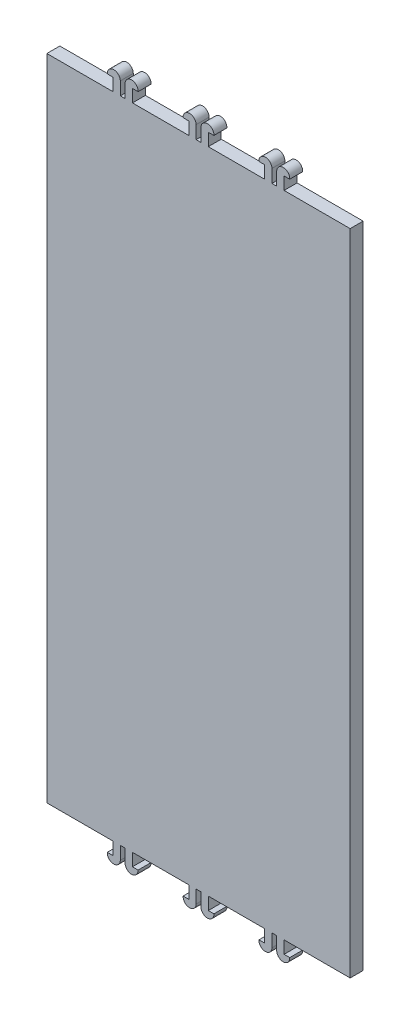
SolidWorks part; units mm, degrees
ref_plane "Front Plane" through (0, 0, 0) normal (0, 0, 1) x (1, 0, 0)
ref_plane "Top Plane" through (0, 0, 0) normal (0, 1, 0) x (1, 0, 0)
ref_plane "Right Plane" through (0, 0, 0) normal (1, 0, 0) x (0, 0, -1)
sketch "Sketch1" plane through (0, 0, 0) normal (0, 0, 1) x (1, 0, 0)
  line L0 (0.654, 37.5) -> (0.654, 40.5) construction
  line L1 (35.05, -37.5) -> (-35.05, -37.5) construction
  line L2 (35.05, -112.5) -> (35.05, 37.5)
  line L3 (35.05, 37.5) -> (19.774, 37.5)
  line L4 (-35.05, -112.5) -> (-35.05, 37.5)
  line L5 (35.05, -37.5) -> (-35.05, 37.5) construction
  line L6 (35.05, 37.5) -> (-35.05, -37.5) construction
  line L7 (2.154, 37.5) -> (2.154, 40.5) construction
  line L8 (2.154, 40.5) -> (3.462, 40.5) construction
  line L9 (0, 0) -> (0, 29.6576) construction
  line L10 (3.462, 40.5) -> (3.462, 37.5) construction
  line L11 (0.554, 37.5) -> (0.554, 40.5)
  line L12 (2.254, 40.4) -> (3.5587, 40.4)
  line L13 (2.254, 37.5) -> (2.254, 40.4)
  line L14 (0.554, 37.5) -> (0.554, 40.5) construction
  line L15 (-2.254, 37.5) -> (-2.254, 40.4)
  line L16 (-2.254, 40.4) -> (-3.5587, 40.4)
  line L17 (-0.554, 37.5) -> (-0.554, 40.5)
  line L18 (0.654, 37.5) -> (-0.554, 37.5)
  line L19 (-2.254, 37.5) -> (-15.271, 37.5)
  line L20 (19.774, -112.5) -> (19.774, -115.4)
  line L21 (0.554, 37.5) -> (-0.554, 37.5)
  line L22 (0.654, 37.5) -> (0.554, 37.5) construction
  line L23 (2.254, 37.5) -> (2.154, 37.5) construction
  line L24 (-2.254, -112.5) -> (-15.271, -112.5)
  line L25 (-2.254, -112.5) -> (-2.254, -115.4)
  line L26 (-2.254, -115.4) -> (-3.5587, -115.4)
  line L27 (-0.554, -112.5) -> (-0.554, -115.5)
  line L28 (0.554, -112.5) -> (-0.554, -112.5)
  line L29 (0.554, -112.5) -> (0.554, -115.5)
  line L30 (2.254, -115.4) -> (3.5587, -115.4)
  line L31 (2.254, -112.5) -> (2.254, -115.4)
  line L32 (35.05, -112.5) -> (19.774, -112.5)
  line L33 (19.774, -115.4) -> (21.0787, -115.4)
  line L34 (15.266, 37.5) -> (2.254, 37.5)
  line L35 (-8.7625, 37.5) -> (-8.7625, 30.1564) construction
  line L36 (-19.779, 37.5) -> (-19.779, 40.4)
  line L37 (-19.779, 40.4) -> (-21.0837, 40.4)
  line L38 (-18.079, 37.5) -> (-18.079, 40.5)
  line L39 (-18.079, 37.5) -> (-16.971, 37.5)
  line L40 (-16.971, 37.5) -> (-16.971, 40.5)
  line L41 (-15.271, 40.4) -> (-13.9663, 40.4)
  line L42 (-15.271, 37.5) -> (-15.271, 40.4)
  line L43 (8.76, 37.5) -> (8.76, 30.1564) construction
  line L44 (-19.779, 37.5) -> (-35.05, 37.5)
  line L45 (-16.971, 37.5) -> (-18.079, 37.5)
  line L46 (15.266, 37.5) -> (15.266, 40.4)
  line L47 (15.266, 40.4) -> (13.9613, 40.4)
  line L48 (16.966, 37.5) -> (16.966, 40.5)
  line L49 (16.966, 37.5) -> (18.074, 37.5)
  line L50 (18.074, 37.5) -> (18.074, 40.5)
  line L51 (19.774, 40.4) -> (21.0787, 40.4)
  line L52 (19.774, 37.5) -> (19.774, 40.4)
  line L53 (18.074, 37.5) -> (16.966, 37.5)
  line L54 (2.254, 37.5) -> (2.154, 37.5)
  line L55 (18.074, -112.5) -> (18.074, -115.5)
  line L56 (16.966, -112.5) -> (18.074, -112.5)
  line L57 (16.966, -112.5) -> (16.966, -115.5)
  line L58 (15.266, -115.4) -> (13.9613, -115.4)
  line L59 (15.266, -112.5) -> (15.266, -115.4)
  line L60 (-15.271, -112.5) -> (-15.271, -115.4)
  line L61 (-15.271, -115.4) -> (-13.9663, -115.4)
  line L62 (-16.971, -112.5) -> (-16.971, -115.5)
  line L63 (-18.079, -112.5) -> (-16.971, -112.5)
  line L64 (-18.079, -112.5) -> (-18.079, -115.5)
  line L65 (-19.779, -112.5) -> (-19.779, -115.4)
  line L66 (-19.779, -115.4) -> (-21.0837, -115.4)
  line L67 (-19.779, -112.5) -> (-35.05, -112.5)
  line L68 (-16.971, -112.5) -> (-18.079, -112.5)
  line L69 (15.266, -112.5) -> (2.254, -112.5)
  line L70 (18.074, -112.5) -> (16.966, -112.5)
  arc A0 (3.462, 40.5) -> (0.654, 40.5) centre (2.058, 40.5) ccw construction
  arc A1 (3.5587, 40.4) -> (0.554, 40.5) centre (2.058, 40.5) ccw
  arc A2 (-3.5587, 40.4) -> (-0.554, 40.5) centre (-2.058, 40.5) cw
  arc A3 (-3.5587, -115.4) -> (-0.554, -115.5) centre (-2.058, -115.5) ccw
  arc A4 (3.5587, -115.4) -> (0.554, -115.5) centre (2.058, -115.5) cw
  arc A5 (-21.0837, 40.4) -> (-18.079, 40.5) centre (-19.583, 40.5) cw
  arc A6 (-13.9663, 40.4) -> (-16.971, 40.5) centre (-15.467, 40.5) ccw
  arc A7 (13.9613, 40.4) -> (16.966, 40.5) centre (15.462, 40.5) cw
  arc A8 (21.0787, 40.4) -> (18.074, 40.5) centre (19.578, 40.5) ccw
  arc A9 (21.0787, -115.4) -> (18.074, -115.5) centre (19.578, -115.5) cw
  arc A10 (13.9613, -115.4) -> (16.966, -115.5) centre (15.462, -115.5) ccw
  arc A11 (-13.9663, -115.4) -> (-16.971, -115.5) centre (-15.467, -115.5) cw
  arc A12 (-21.0837, -115.4) -> (-18.079, -115.5) centre (-19.583, -115.5) ccw
  point P0 (0, 0)
  point P42 (15.266, 38.95)
  point P82 (15.266, -113.95)
  point P96 (-17.525, 37.5)
extrude "Boss-Extrude1" add sketch "Sketch1" along normal blind 3
equation "\"Thick\"= 3"
equation "\"h\"= 3"
equation "\"kerf\"= .2"
equation "\"D7@Sketch1\"= ( \"ancho_total\" / 2 ) - ( ( \"kerf\" / 2 ) + ( \"h\" / 2 ) + ( \"Per_def\" * .5 ) )"
equation "\"Length\"= \"Thick\""
equation "\"D4@Sketch1\" = \"h\" / 2"
equation "\"D5@Sketch1\"= \"h\" / 2"
equation "\"Deflection\"= .4 * \"Thick\""
equation "\"D8@Sketch1\"=\"kerf\"/2"
equation "\"D1@Boss-Extrude1\"=\"Thick\""
equation "\"Strain\"= \"Deflection\" / \"Length\""
equation "\"D3@Sketch1\"=\"Length\""
equation "\"Per_def\"= 1.09 * ( \"Strain\" * \"Length\" * \"Length\" ) / \"h\""
equation "\"D6@Sketch1\" = \"Per_def\" * .5"
equation "\"D2@Sketch1\"= \"Per_def\""
equation "\"ancho_total\"= \"ancho_total_valor\" + \"kerf\" / 2"
equation "\"ancho_total_valor\"= 70"
equation "\"mirror _pestañas\"= ( \"ancho_total_valor\" + \"kerf\" / 2 ) / 8"
equation "\"D10@Sketch1\"=\"mirror _pestañas\""
